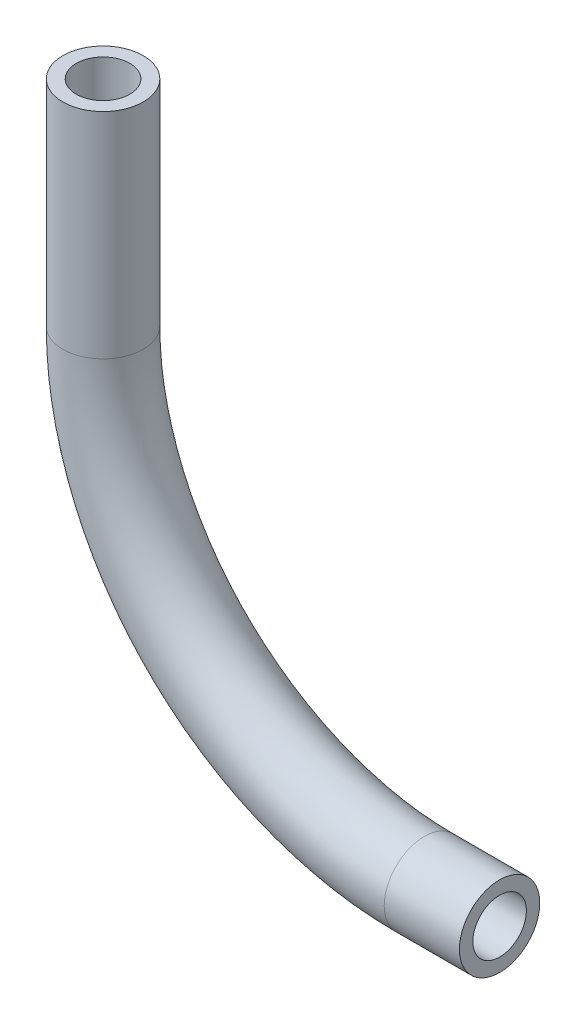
SolidWorks part; units mm, degrees
ref_plane "Front Plane" through (0, 0, 0) normal (0, 0, 1) x (1, 0, 0)
ref_plane "Top Plane" through (0, 0, 0) normal (0, 1, 0) x (1, 0, 0)
ref_plane "Right Plane" through (0, 0, 0) normal (1, 0, 0) x (0, 0, -1)
sketch "Sketch1" plane through (0, 0, 0) normal (0, 0, 1) x (1, 0, 0)
  line L0 (-94.0408, 0) -> (-94.0408, -50.8)
  line L1 (-17.8408, -127) -> (112.3342, -127)
  line L2 (188.5342, -50.8) -> (188.5342, 0)
  line L3 (-49.5908, -88.265) -> (-49.5908, -100.965) construction
  line L4 (144.0842, -100.965) -> (144.0842, -88.265) construction
  arc A0 (112.3342, -127) -> (188.5342, -50.8) centre (112.3342, -50.8) ccw
  arc A1 (-94.0408, -50.8) -> (-17.8408, -127) centre (-17.8408, -50.8) ccw
  point P9 (-94.0408, -127)
  dimension "D2" = 76.2
  dimension "D1" = 127
  dimension "D3" = 44.45
  dimension "D4" = 44.45
sketch "Sketch2" plane through (0, 0, 0) normal (0, 1, 0) x (1, 0, 0)
  circle A0 centre (-94.0408, 0) radius 9.525
  circle A1 centre (-94.0408, 0) radius 6.35
  dimension "D1" = 3.175
  dimension "D2" = 19.05
sweep "Sweep1" add profiles "Sketch2" path "Sketch1"
sketch "Sketch4" [suppressed] plane through (0, 0, 0) normal (0, 0, 1) x (1, 0, 0)
  line L1 (-254, 28.8352) -> (0, 28.8352)
  line L2 (-254, 28.8352) -> (-254, -169.4485)
  line L3 (-254, -169.4485) -> (0, -169.4485)
  line L4 (0, 28.8352) -> (0, -169.4485)
  dimension "D2" = 254
extrude "Cut-Extrude1" [suppressed] cut sketch "Sketch4" against normal through all both and the other way through all
sketch "Sketch5" plane through (0, 0, 0) normal (0, 0, 1) x (1, 0, 0)
  line L1 (0, -162.2939) -> (676.3826, -162.2939)
  line L2 (0, -162.2939) -> (0, 25.0024)
  line L3 (0, 25.0024) -> (676.3826, 25.0024)
  line L4 (676.3826, -162.2939) -> (676.3826, 25.0024)
extrude "Cut-Extrude2" cut sketch "Sketch5" against normal through all both and the other way through all
